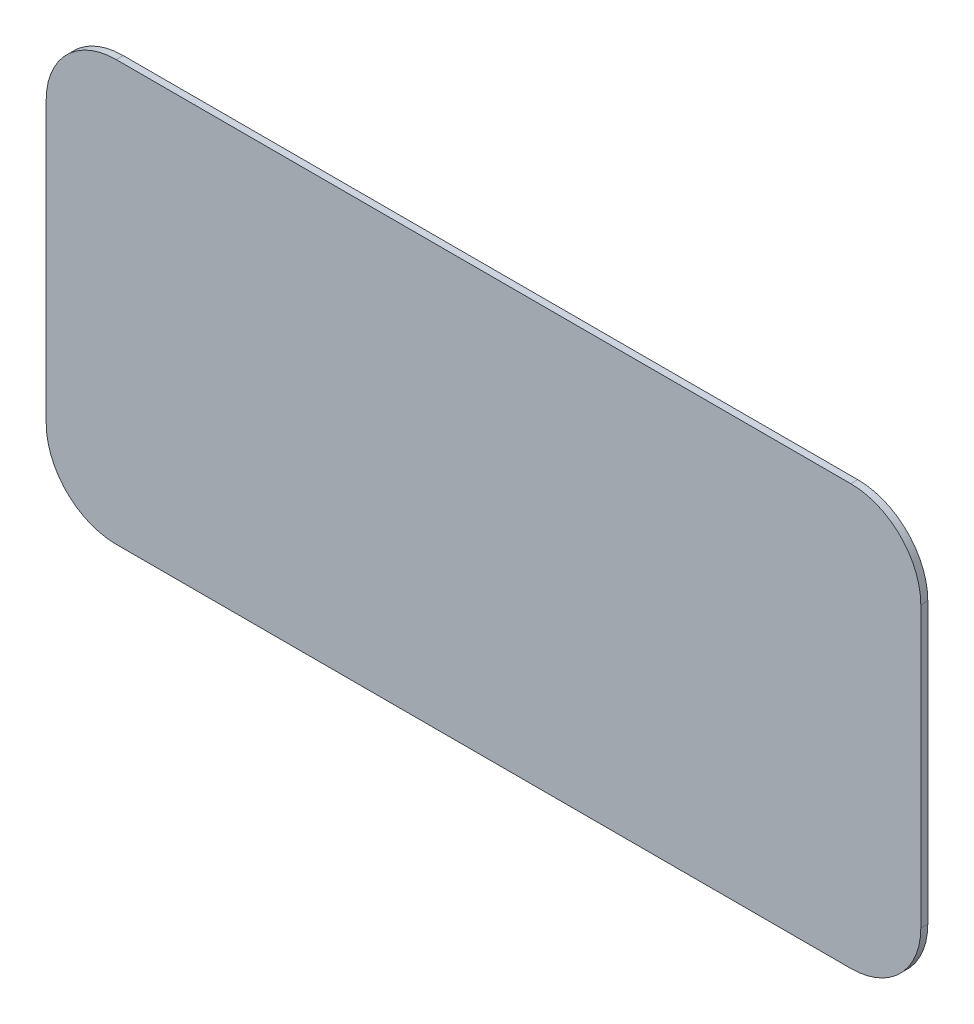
SolidWorks part; units mm, degrees
ref_plane "Face" through (0, 0, 0) normal (0, 0, 1) x (1, 0, 0)
ref_plane "Dessus" through (0, 0, 0) normal (0, 1, 0) x (1, 0, 0)
ref_plane "Droite" through (0, 0, 0) normal (1, 0, 0) x (0, 0, -1)
sketch "Esquisse1" plane through (0, 0, 0) normal (0, 0, 1) x (1, 0, 0)
  line L1 (-21.8488, 2.3382) -> (-0.8488, 2.3382)
  line L2 (-23.8488, 0.3382) -> (-23.8488, -7.6618)
  line L3 (-21.8488, -9.6618) -> (-0.8488, -9.6618)
  line L4 (1.1512, 0.3382) -> (1.1512, -7.6618)
  arc A0 (-0.8488, 2.3382) -> (1.1512, 0.3382) centre (-0.8488, 0.3382) cw
  arc A1 (1.1512, -7.6618) -> (-0.8488, -9.6618) centre (-0.8488, -7.6618) cw
  arc A2 (-21.8488, -9.6618) -> (-23.8488, -7.6618) centre (-21.8488, -7.6618) cw
  arc A3 (-23.8488, 0.3382) -> (-21.8488, 2.3382) centre (-21.8488, 0.3382) cw
  dimension "D3" = 2
  dimension "D1" = 25
  dimension "D2" = 12
extrude "Boss.-Extru.1" add sketch "Esquisse1" along normal blind 0.2
